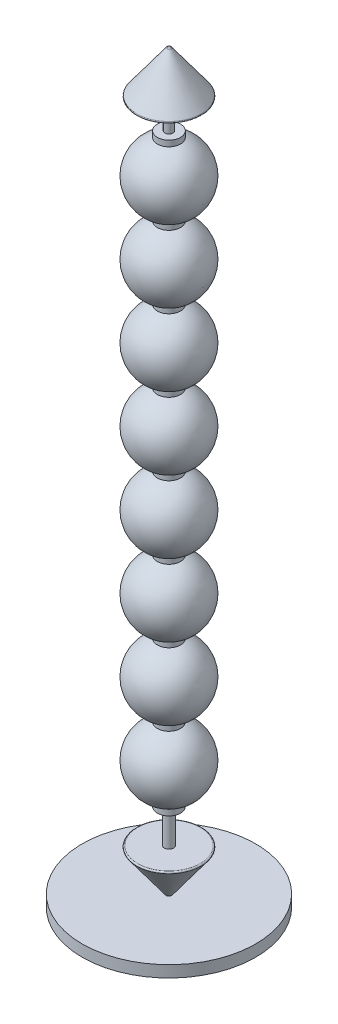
SolidWorks part; units mm, degrees
ref_plane "Alzado" through (0, 0, 0) normal (0, 0, 1) x (1, 0, 0)
ref_plane "Planta" through (0, 0, 0) normal (0, 1, 0) x (1, 0, 0)
ref_plane "Vista lateral" through (0, 0, 0) normal (1, 0, 0) x (0, 0, -1)
sketch "Croquis1" plane through (0, 0, 0) normal (0, 1, 0) x (1, 0, 0)
  circle A0 centre (0, 0) radius 150
  dimension "D1" = 300
extrude "Saliente-Extruir1" add sketch "Croquis1" along normal blind 20
sketch "Croquis2" plane through (0, 20, 0) normal (0, 1, 0) x (1, 0, 0)
  circle A0 centre (0, 0) radius 8
  dimension "D1" = 16
extrude "Saliente-Extruir2" add sketch "Croquis2" along normal blind 150 separate body
sketch "Croquis3" plane through (0, 0, 0) normal (0, 0, 1) x (1, 0, 0)
  line L0 (0, 1237.2468) -> (0, 0) construction
  line L1 (150, 20) -> (-150, 20) construction
  line L2 (0, 160) -> (0, 280)
  arc A0 (0, 160) -> (0, 280) centre (0, 220) cw
  dimension "D1" = 60
  dimension "D2" = 200
revolve "Revolución1" add sketch "Croquis3" angle 360 about L0
sketch "Croquis6" plane through (0, 0, 0) normal (0, 0, 1) x (1, 0, 0)
  line L0 (0, 20) -> (0, 556.5267) construction
  line L1 (150, 20) -> (-150, 20) construction
  line L2 (0, 277.49) -> (20, 277.49)
  line L3 (20, 277.49) -> (20, 287.49)
  line L4 (20, 287.49) -> (0, 287.49)
  line L5 (0, 287.49) -> (0, 277.49)
  dimension "D1" = 20
  dimension "D2" = 10
revolve "Revolución3" add sketch "Croquis6" angle 360 about L0
pattern_linear "MatrizL1" count 8 spacing 125 along (0, 1, 0)
sketch "Croquis5" plane through (0, 0, 0) normal (0, 0, 1) x (1, 0, 0)
  line L0 (0, 1212.49) -> (0, 1287.49) construction
  line L1 (0, 1212.49) -> (-58, 1212.49)
  line L2 (-58, 1212.49) -> (-3.0063, 1287.49)
  line L3 (0, 1212.49) -> (0, 1287.49)
  line L5 (-3.0063, 1287.49) -> (0, 1287.49)
  line L9 (20, 1162.49) -> (-20, 1162.49) construction
  dimension "D2" = 75
  dimension "D1" = 58
  dimension "D3" = 50
revolve "Revolución2" add sketch "Croquis5" angle 360 about L0
fillet "Redondeo2" radius 2 1 edges at (0, 1212.49, -58)
ref_plane "Plano1" through (0, 652.49, 0) normal (0, -1, 0) x (-1, 0, 0)
fillet "Redondeo3" radius 2 1 edges at (0, 1287.49, -3.0063)
mirror "Simetría1" about plane through (0, 652.49, 0) normal (0, -1, 0)
sketch "Croquis7" plane through (0, 0, 0) normal (0, 0, 1) x (1, 0, 0)
  line L0 (0, 1162.49) -> (0, 1212.49) construction
  line L1 (20, 1162.49) -> (-20, 1162.49) construction
  line L2 (-54.0535, 1212.49) -> (54.0535, 1212.49) construction
  line L3 (0, 1162.49) -> (-7, 1162.49)
  line L4 (-7, 1162.49) -> (-7, 1212.49)
  line L5 (-7, 1212.49) -> (0, 1212.49)
  line L7 (0, 1162.49) -> (0, 1212.49)
  dimension "D1" = 7
revolve "Revolución4" add sketch "Croquis7" angle 360 about L0
sketch "Croquis8" plane through (0, 0, 0) normal (0, 0, 1) x (1, 0, 0)
  line L0 (0, 0) -> (0, 160.7371) construction
  line L2 (0, 160.7371) -> (20, 160.7371)
  line L3 (0, 160.7371) -> (0, 150.7371)
  line L4 (0, 150.7371) -> (20, 150.7371)
  line L5 (20, 160.7371) -> (20, 150.7371)
  dimension "D1" = 20
  dimension "D2" = 10
revolve "Revolución5" add sketch "Croquis8" angle 360 about L0
sketch "Croquis9" plane through (0, 0, 0) normal (0, 0, 1) x (1, 0, 0)
  line L0 (150, 20) -> (-150, 20) construction
  line L1 (-19.6901, 20) -> (16.7875, 20)
  line L2 (-19.6901, 20) -> (-19.6901, 27.7178)
  line L3 (-19.6901, 27.7178) -> (16.7875, 27.7178)
  line L4 (16.7875, 20) -> (16.7875, 27.7178)
extrude "Cortar-Extruir1" cut sketch "Croquis9" against normal mid plane 20
